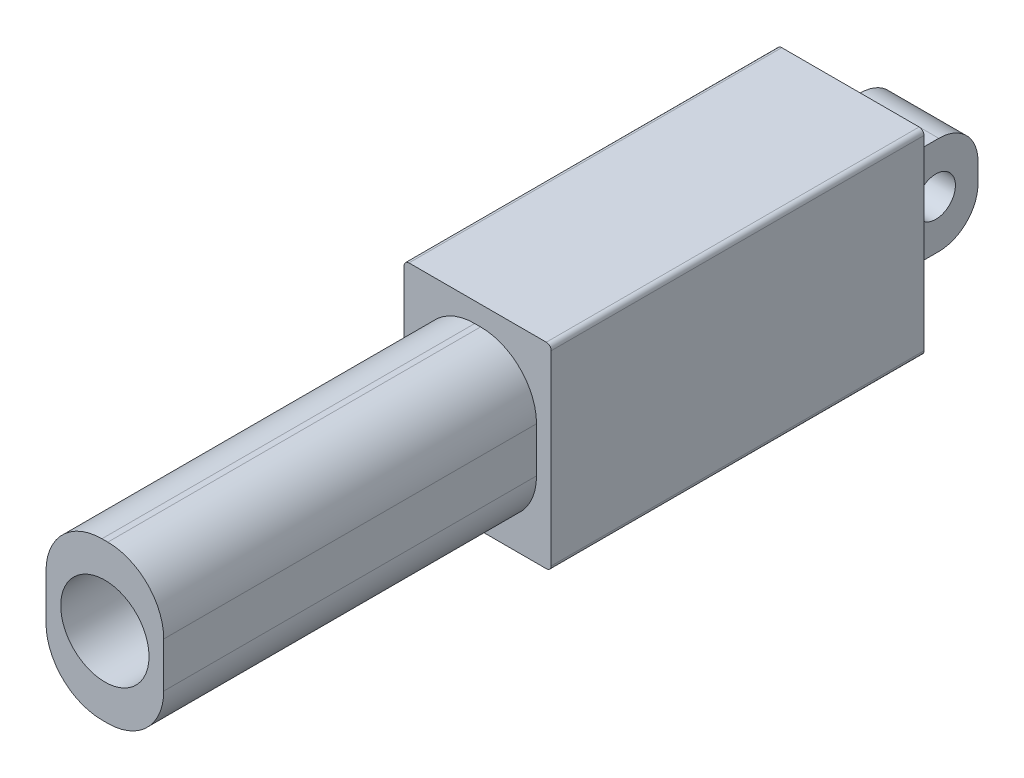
SolidWorks part; units mm, degrees
ref_plane "Спереди" through (0, 0, 0) normal (0, 0, 1) x (1, 0, 0)
ref_plane "Сверху" through (0, 0, 0) normal (0, 1, 0) x (1, 0, 0)
ref_plane "Справа" through (0, 0, 0) normal (1, 0, 0) x (0, 0, -1)
sketch "Эскиз1" plane through (0, 0, 0) normal (0, 0, 1) x (1, 0, 0)
  line L1 (7.5, -10) -> (-7.5, -10)
  line L2 (7.5, -10) -> (7.5, 10)
  line L3 (7.5, 10) -> (-7.5, 10)
  line L4 (-7.5, -10) -> (-7.5, 10)
  line L5 (7.5, -10) -> (-7.5, 10) construction
  line L6 (7.5, 10) -> (-7.5, -10) construction
  point P0 (0, 0)
  dimension "D1" = 15
  dimension "D2" = 20
extrude "Бобышка-Вытянуть1" add sketch "Эскиз1" along normal blind 38
sketch "Эскиз2" plane through (0, 0, 38) normal (0, 0, 1) x (1, 0, 0)
  line L1 (0.3, -8) -> (-0.3, -8)
  line L2 (6, -2.3) -> (6, 2.3)
  line L3 (0.3, 8) -> (-0.3, 8)
  line L4 (-6, -2.3) -> (-6, 2.3)
  line L5 (6, -8) -> (-6, 8) construction
  line L6 (6, 8) -> (-6, -8) construction
  arc A0 (-0.3, -8) -> (-6, -2.3) centre (-0.3, -2.3) cw
  arc A1 (0.3, -8) -> (6, -2.3) centre (0.3, -2.3) ccw
  arc A2 (0.3, 8) -> (6, 2.3) centre (0.3, 2.3) cw
  arc A3 (-0.3, 8) -> (-6, 2.3) centre (-0.3, 2.3) ccw
  point P0 (0, 0)
  dimension "D3" = 5.7
  dimension "D1" = 12
  dimension "D2" = 16
extrude "Бобышка-Вытянуть2" add sketch "Эскиз2" along normal blind 38
sketch "Эскиз3" plane through (0, 0, 0) normal (0, 0, -1) x (-1, 0, 0)
  line L1 (-4, -5) -> (4, -5)
  line L2 (-4, -5) -> (-4, 5)
  line L3 (-4, 5) -> (4, 5)
  line L4 (4, -5) -> (4, 5)
  line L5 (-4, -5) -> (4, 5) construction
  line L6 (-4, 5) -> (4, -5) construction
  point P0 (0, 0)
  dimension "D1" = 8
  dimension "D2" = 10
extrude "Бобышка-Вытянуть3" add sketch "Эскиз3" along normal blind 9
fillet "Скругление1" radius 4 2 edges at (0, -5, -9) (0, 5, -9)
sketch "Эскиз4" plane through (-4, 0, 0) normal (-1, 0, 0) x (0, 0, 1)
  line L0 (-9, -1) -> (-9, 1) construction
  circle A0 centre (-4.7, 0) radius 2
  dimension "D1" = 4
  dimension "D2" = 4.3
extrude "Вырез-Вытянуть1" cut sketch "Эскиз4" against normal through all
fillet "Скругление2" radius 0.5 4 edges at (7.5, 10, 19) (7.5, -10, 19) (-7.5, 10, 19) (-7.5, -10, 19)
sketch "Эскиз5" plane through (0, 0, 76) normal (0, 0, 1) x (1, 0, 0)
  circle A0 centre (0, 0) radius 4.5
  dimension "D1" = 9
extrude "Вырез-Вытянуть2" cut sketch "Эскиз5" against normal blind 35
